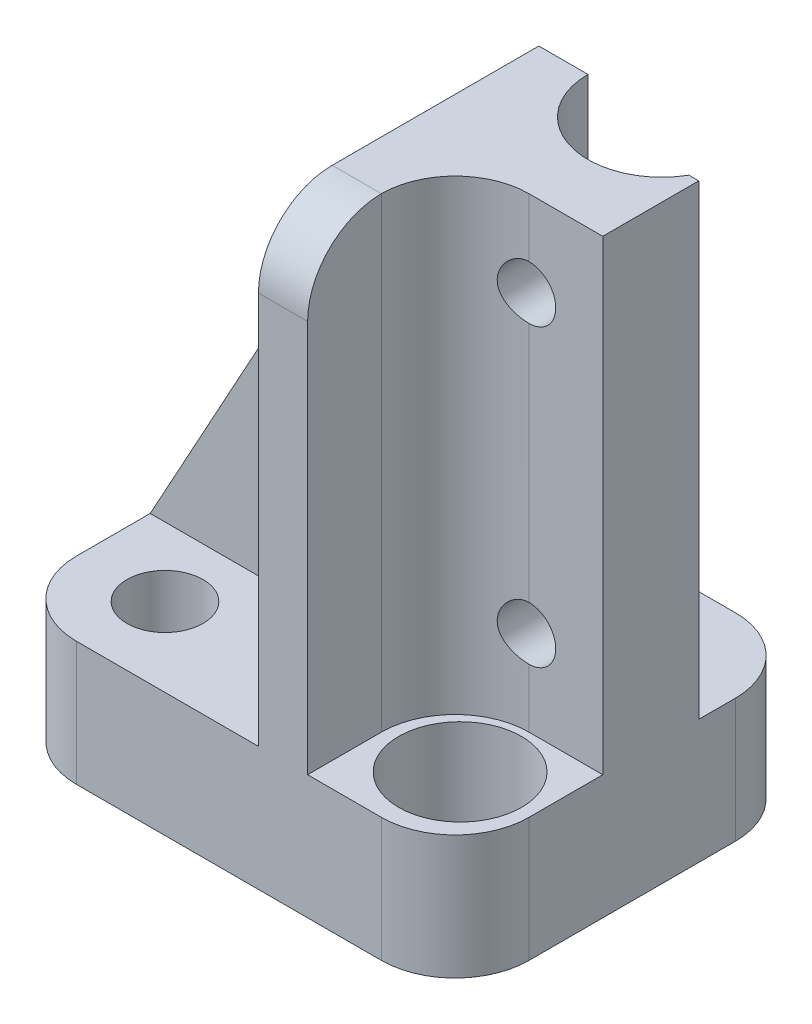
SolidWorks part; units mm, degrees
ref_plane "Front Plane" through (0, 0, 0) normal (0, 0, 1) x (1, 0, 0)
ref_plane "Top Plane" through (0, 0, 0) normal (0, 1, 0) x (1, 0, 0)
ref_plane "Right Plane" through (0, 0, 0) normal (1, 0, 0) x (0, 0, -1)
sketch "Sketch1" plane through (0, 0, 0) normal (0, 0, 1) x (1, 0, 0)
  line L0 (-24.4475, 0) -> (4.7625, 0)
  line L1 (4.7625, 0) -> (4.7625, 38.1)
  line L2 (4.7625, 38.1) -> (-7.9375, 38.1)
  line L4 (-24.4475, 8.001) -> (-24.4475, 0)
  line L6 (-24.4475, 8.001) -> (-7.9375, 38.1)
  dimension "D1" = 38.1
  dimension "D2" = 29.21
  dimension "D3" = 8.001
  dimension "D4" = 12.7
  dimension "D5" = 4.7625
extrude "Boss-Extrude1" add sketch "Sketch1" along normal mid plane 39.37
sketch "Sketch3" plane through (0, 38.1, 0) normal (0, 1, 0) x (1, 0, 0)
  line L1 (-4.7625, 0) -> (-7.9375, 0)
  line L3 (-7.9375, -19.685) -> (-7.9375, 19.685) construction
  line L9 (-24.4475, -19.685) -> (-7.9375, -19.685)
  line L11 (-24.4475, -19.685) -> (-24.4475, -8.5725)
  line L14 (-24.4475, -8.5725) -> (-7.9375, -8.5725)
  line L16 (4.7625, 19.685) -> (-7.9375, 19.685)
  line L17 (4.7625, 19.685) -> (-7.9375, 19.685) construction
  line L18 (-7.9375, 19.685) -> (-7.9375, 0)
  line L19 (4.7625, 19.685) -> (4.7625, -2.376)
  line L20 (4.7625, -19.685) -> (4.7625, 19.685) construction
  line L21 (4.7625, -2.376) -> (4.1275, -2.376)
  line L22 (-7.9375, -19.685) -> (-7.9375, -8.5725)
  line L24 (4.7625, -19.685) -> (-4.7625, -19.685)
  line L25 (4.7625, -19.685) -> (4.7625, -8.5725)
  line L26 (4.7625, -8.5725) -> (-4.7625, -8.5725)
  line L27 (-4.7625, -19.685) -> (-4.7625, -8.5725)
  arc A2 (-4.7625, 0) -> (4.1275, -2.376) centre (0, 0) ccw
  dimension "D1" = 9.525
  dimension "D3" = 3.81
  dimension "D2" = 0.635
extrude "Cut-Extrude2" cut sketch "Sketch3" against normal up to vertex (30.099 mm away)
sketch "Sketch5" plane through (0, 38.1, 0) normal (0, 1, 0) x (1, 0, 0)
  line L5 (-24.4475, -19.685) -> (-24.4475, 19.685) construction
  line L6 (4.7625, -2.376) -> (4.7625, 19.685) construction
  line L7 (-24.4475, 19.685) -> (4.7625, 19.685)
  line L8 (-24.4475, 19.685) -> (-24.4475, -6.0325)
  line L10 (4.7625, 19.685) -> (4.7625, 0)
  line L12 (-7.9375, 4.7625) -> (-7.9375, -6.0325)
  line L13 (-7.9375, -6.0325) -> (-24.4475, -6.0325)
  line L14 (0, 4.7625) -> (-7.9375, 4.7625)
  line L15 (-7.9375, -8.5725) -> (-7.9375, 0) construction
  line L16 (-24.4475, -8.5725) -> (-7.9375, -8.5725) construction
  arc A0 (4.7625, 0) -> (0, 4.7625) centre (0, 0) ccw
  arc A1 (-4.7625, 0) -> (4.1275, -2.376) centre (0, 0) ccw construction
  dimension "D1" = 2.54
extrude "Cut-Extrude4" cut sketch "Sketch5" against normal through all
sketch "Sketch18" plane through (0, 38.1, 0) normal (0, 1, 0) x (1, 0, 0)
  line L0 (4.7625, -19.685) -> (4.7625, -8.5725) construction
  line L1 (-24.4475, -19.685) -> (4.7625, -19.685)
  line L2 (-24.4475, -19.685) -> (-24.4475, -18.0975)
  line L3 (-24.4475, -18.0975) -> (4.7625, -18.0975)
  line L4 (4.7625, -19.685) -> (4.7625, -18.0975)
  line L5 (4.7625, -8.5725) -> (-4.7625, -8.5725) construction
  dimension "D1" = 9.525
extrude "Cut-Extrude8" cut sketch "Sketch18" against normal through all
hole_wizard "#10 (0.1935) Diameter Hole2" positions "Sketch8" profile "Sketch9" hole size "#10" standard "ANSI Inch"
sketch "Sketch8" plane through (0, 8.001, 0) normal (0, 1, 0) x (1, 0, 0)
  line L11 (4.7625, -8.5725) -> (-4.7625, -8.5725) construction
  point P0 (-19.05, -13.0175)
  point P2 (0, -13.0175)
  dimension "D1" = 4.445
  dimension "D2" = 19.05
sketch "Sketch9" plane through (-19.05, 8.001, 13.0175) normal (1, 0, 0) x (0, 0, 1)
  line L0 (0, 0) -> (0, 8.001)
  line L1 (0, 8.001) -> (2.4574, 8.001)
  line L2 (2.4574, 8.001) -> (2.4574, 0)
  line L5 (2.4574, 0) -> (0, 0)
  line L11 (0, -6.35) -> (0, 107.95) construction
  dimension "Thru Hole Dia." = 4.9149
  dimension "Thru Hole Depth" = 8.001
fillet "Fillet2" radius 4.7625 6 edges at (-7.9375, 4.0005, -4.7625) (-7.9375, 19.05, 6.0325) (-7.9375, 23.0505, 8.5725) (-4.7625, 23.0505, 8.5725) (4.7625, 4.0005, 18.0975) (-24.4475, 4.0005, 18.0975)
hole_wizard "#8-32 Tapped Hole1" positions "Sketch13" profile "Sketch14" tap size "#8-32" standard "ANSI Inch"
sketch "Sketch13" plane through (0, 0, 18.0975) normal (0, 0, 1) x (1, 0, 0)
  line L2 (0, 38.1) -> (0, 8.001) construction
  line L4 (-4.7625, 23.0505) -> (0, 23.0505) construction
  line L6 (0, 8.001) -> (0, 38.1) construction
  line L7 (4.7625, 8.001) -> (0, 8.001) construction
  line L8 (4.7625, 38.1) -> (0, 38.1) construction
  line L9 (-4.7625, 38.1) -> (-4.7625, 8.001) construction
  point P14 (0, 32.5755)
  point P16 (0, 13.5255)
  dimension "D1" = 19.05
sketch "Sketch14" plane through (0, 13.5255, 18.0975) normal (1, 0, 0) x (0, -1, 0)
  line L0 (0, 0) -> (0, 22.86)
  line L1 (0, 22.86) -> (1.7272, 22.86)
  line L2 (1.7272, 22.86) -> (1.7272, 0)
  line L5 (1.7272, 0) -> (0, 0)
  line L11 (0, -6.35) -> (0, 107.95) construction
  dimension "Thread Major Dia." = 3.4544
  dimension "Thru Tap Drill Depth" = 22.86
hole_wizard "CBORE for #8 Socket Head Cap Screw2" positions "Sketch16" profile "Sketch17" counterbore size "#8" standard "ANSI Inch"
sketch "Sketch16" plane through (0, 8.001, 0) normal (0, 1, 0) x (1, 0, 0)
  point P0 (0, -13.0175)
sketch "Sketch17" plane through (0, 8.001, 13.0175) normal (1, 0, 0) x (0, 0, 1)
  line L0 (0, 0) -> (0, 8.001)
  line L1 (0, 8.001) -> (2.4574, 8.001)
  line L3 (2.4574, 8.001) -> (2.4575, 5.8166)
  line L4 (2.4575, 5.8166) -> (3.9687, 5.8166)
  line L5 (3.9687, 5.8166) -> (3.9687, 0)
  line L7 (3.9687, 0) -> (0, 0)
  line L11 (0, -6.35) -> (0, 107.95) construction
  dimension "Thru Hole Dia." = 4.9149
  dimension "Thru Hole Depth" = 8.001
  dimension "C'Bore Dia." = 7.9375
  dimension "C'Bore Depth" = 5.8166
fillet "Fillet3" radius 4.7625 1 edges at (-6.35, 38.1, 18.0975)
